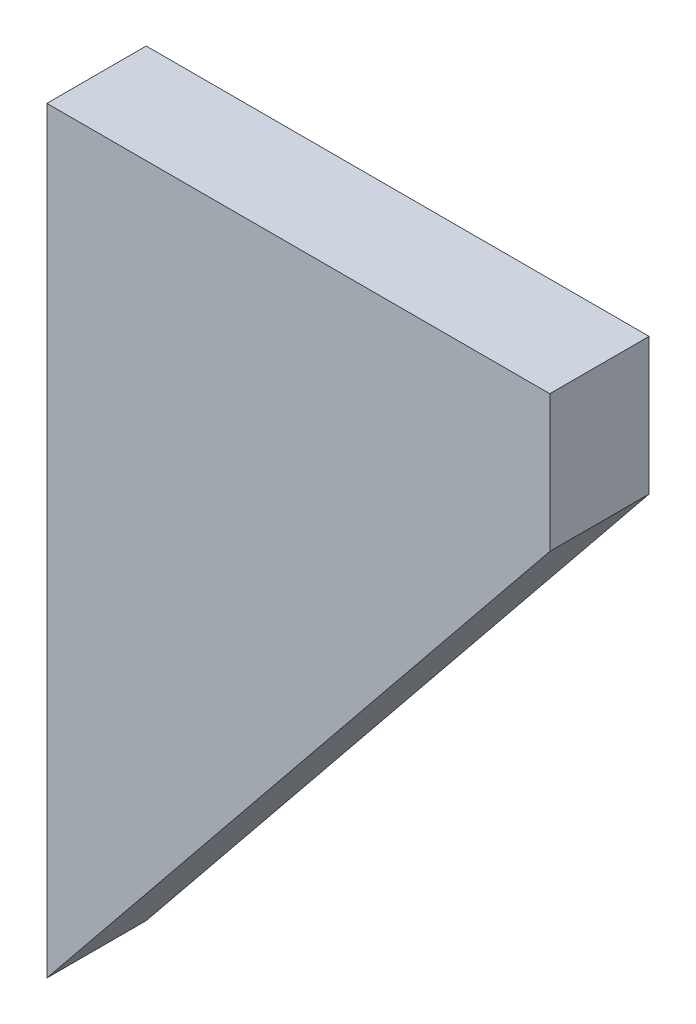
SolidWorks part; units mm, degrees
ref_plane "Plan de face" through (0, 0, 0) normal (0, 0, 1) x (1, 0, 0)
ref_plane "Plan de dessus" through (0, 0, 0) normal (0, 1, 0) x (1, 0, 0)
ref_plane "Plan de droite" through (0, 0, 0) normal (1, 0, 0) x (0, 0, -1)
sketch "Esquisse1" plane through (0, 0, 0) normal (0, 0, 1) x (1, 0, 0)
  line L0 (0, 0) -> (0, 61)
  line L1 (0, 61) -> (40.5, 61)
  line L2 (40.5, 61) -> (40.5, 50)
  line L3 (40.5, 50) -> (0, 0)
  dimension "D1" = 40.5
  dimension "D2" = 11
  dimension "D3" = 61
extrude "Extrusion1" add sketch "Esquisse1" along normal blind 8
